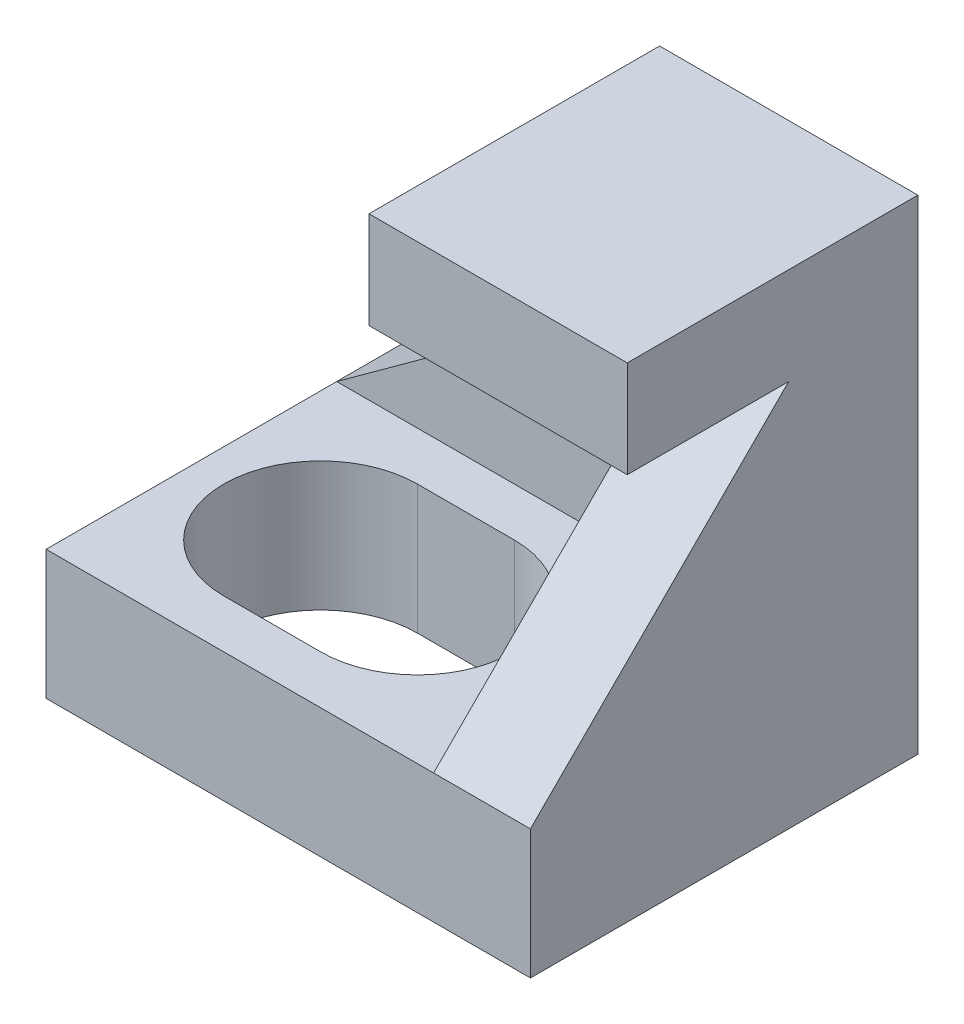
SolidWorks part; units mm, degrees
ref_plane "前视基准面" through (0, 0, 0) normal (0, 0, 1) x (1, 0, 0)
ref_plane "上视基准面" through (0, 0, 0) normal (0, 1, 0) x (1, 0, 0)
ref_plane "右视基准面" through (0, 0, 0) normal (1, 0, 0) x (0, 0, -1)
sketch "草图1" plane through (0, 0, 0) normal (0, 1, 0) x (1, 0, 0)
  line L1 (0, 0) -> (75, 0)
  line L2 (0, 0) -> (0, 60)
  line L3 (0, 60) -> (75, 60)
  line L4 (75, 0) -> (75, 60)
  dimension "D1" = 75
  dimension "D2" = 60
extrude "拉伸1" add sketch "草图1" along normal blind 20
sketch "草图2" plane through (0, 0, -60) normal (0, 0, -1) x (-1, 0, 0)
  line L0 (0, 20) -> (-55, 60)
  line L1 (-55, 60) -> (-75, 60)
  line L2 (-75, 60) -> (-75, 20)
  line L3 (-75, 20) -> (0, 20)
  dimension "D1" = 20
  dimension "D2" = 40
extrude "拉伸2" add sketch "草图2" against normal blind 15
sketch "草图3" plane through (75, 0, 0) normal (1, 0, 0) x (0, 0, -1)
  line L0 (0, 20) -> (40, 60)
  line L1 (40, 60) -> (60, 60)
  line L2 (60, 60) -> (60, 20)
  line L3 (60, 20) -> (0, 20)
  dimension "D1" = 20
extrude "拉伸3" add sketch "草图3" against normal blind 15
sketch "草图4" plane through (0, 60, 0) normal (0, 1, 0) x (1, 0, 0)
  line L0 (0, 60) -> (55, 60) construction
  line L1 (35, 60) -> (75, 60)
  line L2 (35, 60) -> (35, 15)
  line L3 (35, 15) -> (75, 15)
  line L4 (75, 60) -> (75, 15)
  line L5 (75, 40) -> (75, 0) construction
  dimension "D1" = 40
  dimension "D2" = 45
extrude "拉伸4" add sketch "草图4" along normal blind 15
sketch "草图5" plane through (0, 20, 0) normal (0, 1, 0) x (1, 0, 0)
  line L0 (20, 22.5) -> (35, 22.5) construction
  line L1 (20, 7.5) -> (35, 7.5)
  line L2 (20, 37.5) -> (35, 37.5)
  line L3 (0, 45) -> (0, 0) construction
  line L4 (60, 45) -> (0, 45) construction
  line L5 (0, 0) -> (60, 0) construction
  arc A0 (20, 7.5) -> (20, 37.5) centre (20, 22.5) cw
  arc A1 (35, 7.5) -> (35, 37.5) centre (35, 22.5) ccw
  dimension "D3" = 15
  dimension "D4" = 20
  dimension "D1" = 15
  dimension "D2" = 15
extrude "切除-拉伸1" cut sketch "草图5" against normal through all
